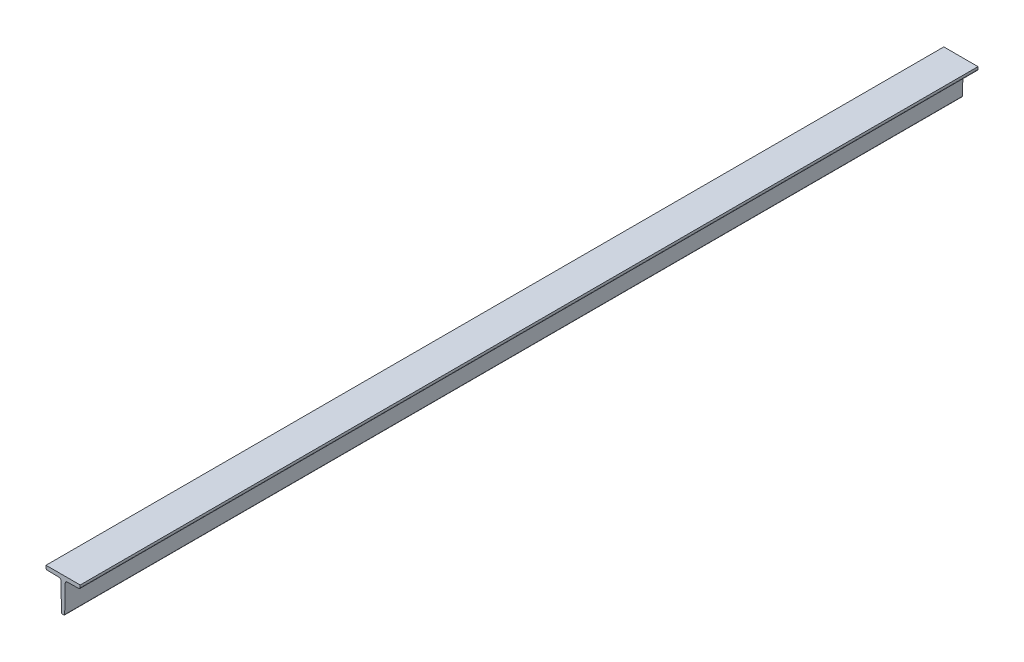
SolidWorks part; units mm, degrees
ref_plane "Ebene vorne" through (0, 0, 0) normal (0, 0, 1) x (1, 0, 0)
ref_plane "Ebene oben" through (0, 0, 0) normal (0, 1, 0) x (1, 0, 0)
ref_plane "Ebene rechts" through (0, 0, 0) normal (1, 0, 0) x (0, 0, -1)
sketch "Skizze1" plane through (0, 0, 0) normal (0, 0, 1) x (1, 0, 0)
  line L0 (-40, 0) -> (40, 0)
  line L2 (-3.739, -78.04) -> (-5.0277, -13.6204)
  line L3 (-9.4368, -9.2113) -> (-36.8885, -8.6622)
  line L5 (-40, 0) -> (-40, -5.4878)
  line L6 (40, 0) -> (40, -5.4878)
  line L7 (36.8885, -8.6622) -> (9.4368, -9.2113)
  line L8 (5.0277, -13.6204) -> (3.739, -78.04)
  line L9 (28.6844, -9) -> (-9.3499, -9) construction
  line L10 (0, 28.1182) -> (0, -74.9267) construction
  line L11 (24.9399, -40) -> (-13.1331, -40) construction
  line L12 (-1.7394, -80) -> (1.7394, -80)
  arc A0 (-5.0277, -13.6204) -> (-9.4368, -9.2113) centre (-9.5268, -13.7104) ccw
  arc A1 (9.4368, -9.2113) -> (5.0277, -13.6204) centre (9.5268, -13.7104) ccw
  arc A2 (-36.8885, -8.6622) -> (-40, -5.4878) centre (-36.825, -5.4878) cw
  arc A3 (36.8885, -8.6622) -> (40, -5.4878) centre (36.825, -5.4878) ccw
  arc A4 (-1.7394, -80) -> (-3.739, -78.04) centre (-1.7394, -78) cw
  arc A5 (3.739, -78.04) -> (1.7394, -80) centre (1.7394, -78) cw
  point P23 (40, -8.5999)
  point P26 (-3.6998, -80)
  point P29 (3.6998, -80)
  dimension "D2" = 3.175
  dimension "D1" = 4.5
  dimension "D5" = 2
  dimension "D3" = 8.5999
  dimension "BF" = 80
  dimension "Angle" = 1.146
  dimension "DEPTH" = 80
  dimension "TF" = 9
  dimension "BF2" = 40
  dimension "D4" = 7.3997
  dimension "Depth2" = 40
extrude "Linear austragen1" add sketch "Skizze1" along normal mid plane 2102
